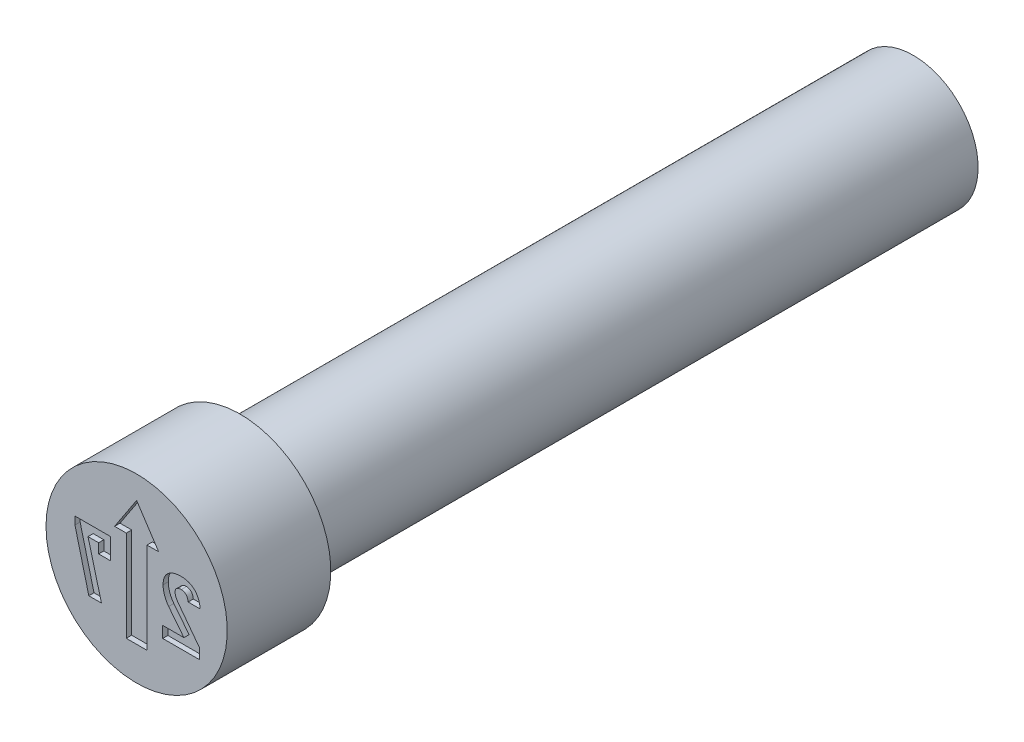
SolidWorks part; units mm, degrees
ref_plane "Front Plane" through (0, 0, 0) normal (0, 0, 1) x (1, 0, 0)
ref_plane "Top Plane" through (0, 0, 0) normal (0, 1, 0) x (1, 0, 0)
ref_plane "Right Plane" through (0, 0, 0) normal (1, 0, 0) x (0, 0, -1)
imported_body "Imported1"
sketch "Sketch1" plane through (0, 0, -0.2845) normal (0, 0, 1) x (1, 0, 0)
  line L7 (0.4256, 0.6604) -> (0, 1.3065)
  line L8 (0, 1.3065) -> (-0.4256, 0.6604)
  line L9 (-0.4256, 0.6604) -> (-0.2, 0.6604)
  line L10 (-0.2, 0.6604) -> (-0.2, -1.1)
  line L11 (-0.2, -1.1) -> (0.2, -1.1)
  line L12 (0.2, -1.1) -> (0.2, 0.6604)
  line L13 (0.2, 0.6604) -> (0.4256, 0.6604)
  line L14 (0.4256, 0.6604) -> (0, 1.3065)
  line L15 (0, 1.3065) -> (-0.4256, 0.6604)
  line L16 (-0.4256, 0.6604) -> (-0.2, 0.6604)
  line L17 (-0.2, 0.6604) -> (-0.2, -1.1)
  line L18 (-0.2, -1.1) -> (0.2, -1.1)
  line L19 (0.2, -1.1) -> (0.2, 0.6604)
  line L20 (0.2, 0.6604) -> (0.4256, 0.6604)
  dimension "D1" = 0
extrude "Boss-Extrude1" add sketch "Sketch1" along normal blind 0.18
sketch "Sketch2" plane through (0, 0, 0) normal (0, 0, 1) x (1, 0, 0)
  text T0 "2   7" font "Bahnschrift" height 1.2
  dimension "D1" = 0.75
  dimension "D2" = 1.3
extrude "Cut-Extrude1" cut sketch "Sketch2" against normal blind 0.1
